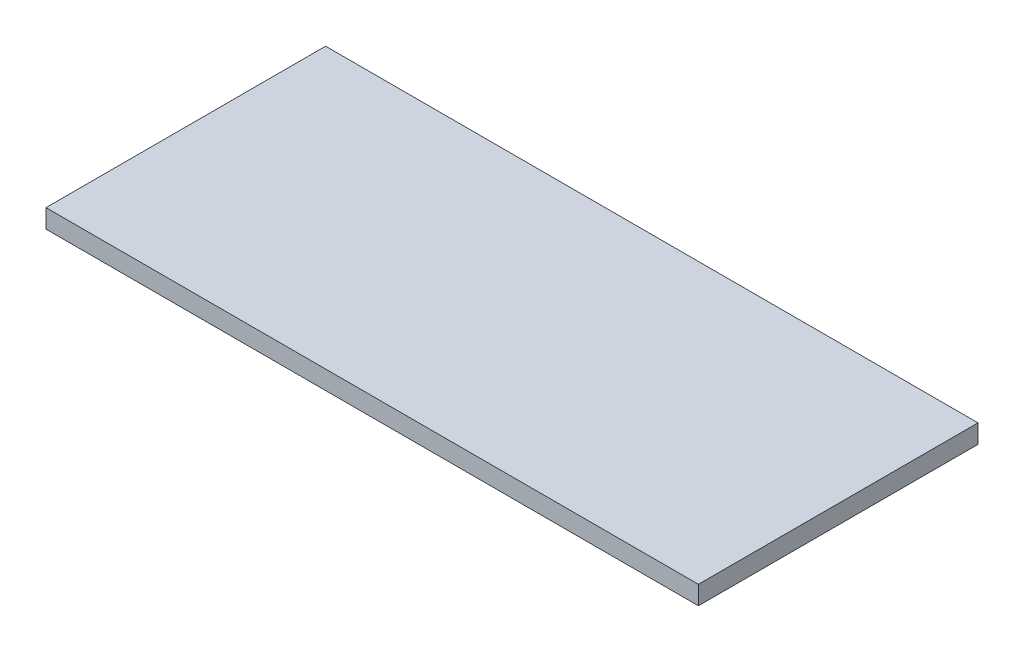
SolidWorks part; units mm, degrees
ref_plane "Face" through (0, 0, 0) normal (0, 0, 1) x (1, 0, 0)
ref_plane "Dessus" through (0, 0, 0) normal (0, 1, 0) x (1, 0, 0)
ref_plane "Droite" through (0, 0, 0) normal (1, 0, 0) x (0, 0, -1)
sketch "Esquisse1" plane through (0, 0, 0) normal (0, 0, 1) x (1, 0, 0)
  line L1 (-200, 0) -> (500, 0)
  line L2 (-200, 0) -> (-200, -20)
  line L3 (-200, -20) -> (500, -20)
  line L4 (500, 0) -> (500, -20)
  dimension "D1" = 20
  dimension "D2" = 200
  dimension "D3" = 700
extrude "Extrusion1" add sketch "Esquisse1" along normal mid plane 300
